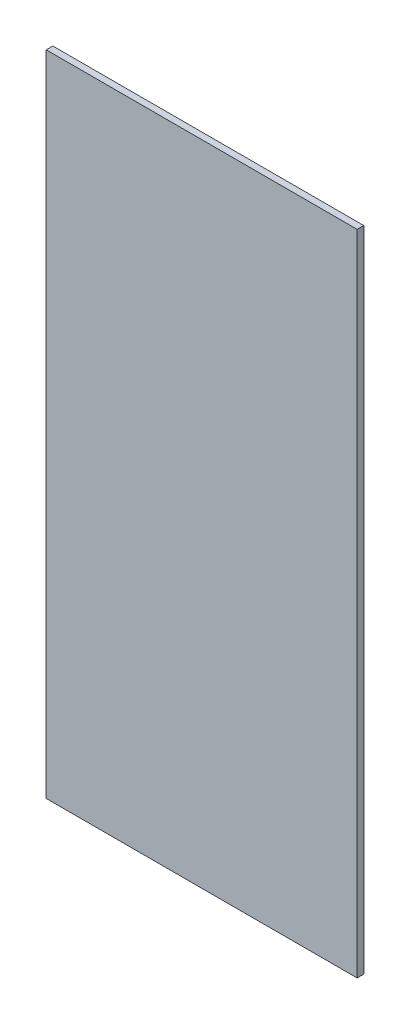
SolidWorks part; units mm, degrees
ref_plane "Front" through (0, 0, 0) normal (0, 0, 1) x (1, 0, 0)
ref_plane "Top" through (0, 0, 0) normal (0, 1, 0) x (1, 0, 0)
ref_plane "Right" through (0, 0, 0) normal (1, 0, 0) x (0, 0, -1)
sketch "草图1" plane through (0, 0, 0) normal (0, 0, 1) x (1, 0, 0)
  line L1 (-21.6431, 40.1696) -> (25.3569, 40.1696)
  line L2 (-21.6431, 40.1696) -> (-21.6431, -57.8304)
  line L3 (-21.6431, -57.8304) -> (25.3569, -57.8304)
  line L4 (25.3569, 40.1696) -> (25.3569, -57.8304)
  dimension "D1" = 98
  dimension "D2" = 47
extrude "凸台-拉伸1" add sketch "草图1" along normal blind 1
